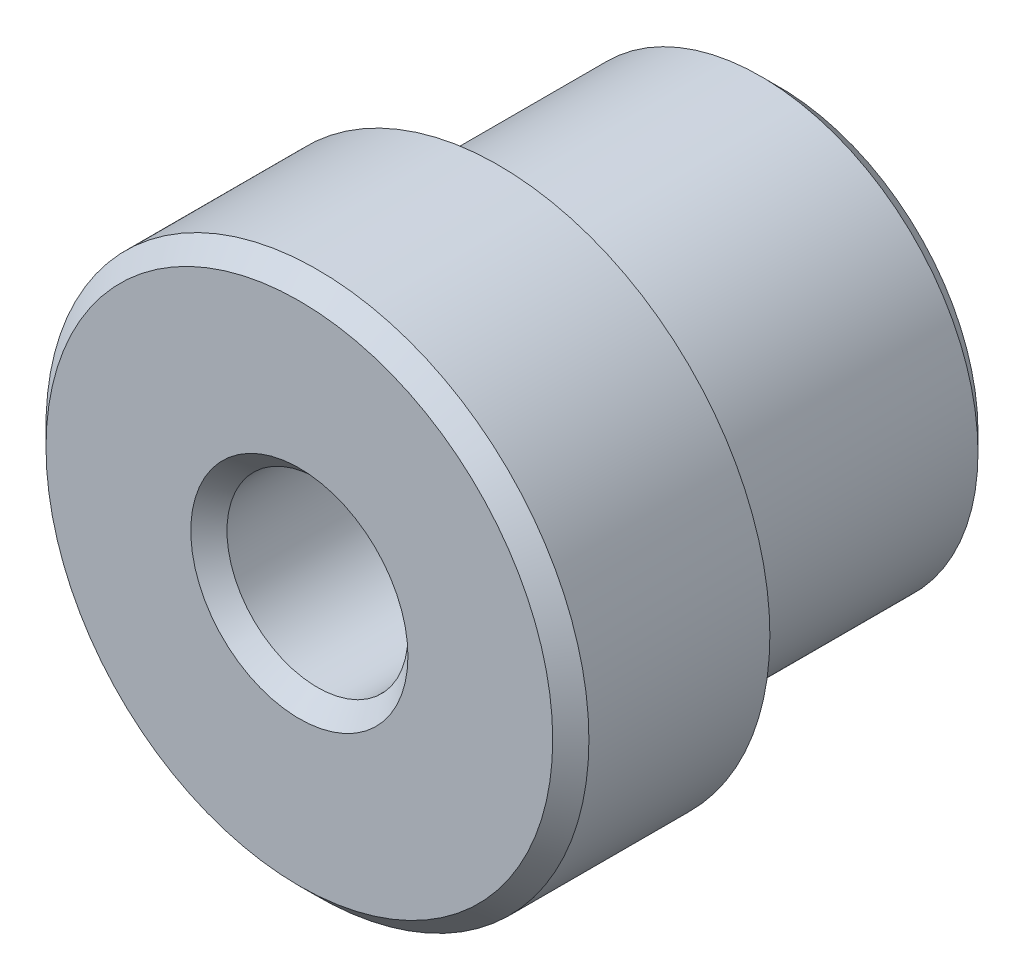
SolidWorks part; units mm, degrees
ref_plane "Plan de face" through (0, 0, 0) normal (0, 0, 1) x (1, 0, 0)
ref_plane "Plan de dessus" through (0, 0, 0) normal (0, 1, 0) x (1, 0, 0)
ref_plane "Plan de droite" through (0, 0, 0) normal (1, 0, 0) x (0, 0, -1)
sketch "Esquisse1" plane through (0, 0, 0) normal (0, 0, 1) x (1, 0, 0)
  circle A0 centre (0, 0) radius 5
  circle A1 centre (0, 0) radius 12
  dimension "D1" = 24
  dimension "D2" = 10
extrude "Boss.-Extru.1" add sketch "Esquisse1" along normal blind 15.5
sketch "Esquisse2" plane through (0, 0, 15.5) normal (0, 0, 1) x (1, 0, 0)
  circle A0 centre (0, 0) radius 5
  circle A1 centre (0, 0) radius 15
  circle A2 centre (0, 0) radius 5 construction
  dimension "D1" = 30
extrude "Boss.-Extru.2" add sketch "Esquisse2" along normal blind 11
chamfer "Chanfrein1" distance 1 angle 45 4 edges at (5, 0, 0) (12, 0, 0) (5, 0, 26.5) (15, 0, 26.5)
